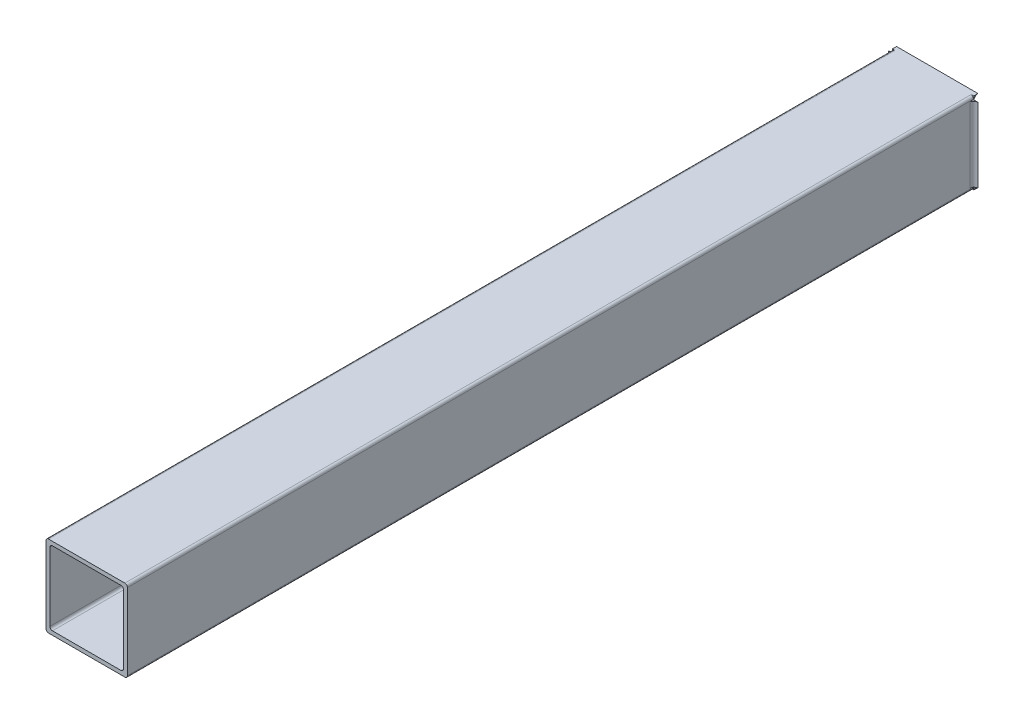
SolidWorks part; units mm, degrees
ref_plane "Front Plane" through (0, 0, 0) normal (0, 0, 1) x (1, 0, 0)
ref_plane "Top Plane" through (0, 0, 0) normal (0, 1, 0) x (1, 0, 0)
ref_plane "Right Plane" through (0, 0, 0) normal (1, 0, 0) x (0, 0, -1)
sketch "Sketch1" plane through (0, 0, 0) normal (0, 0, 1) x (1, 0, 0)
  line L1 (-31.75, -31.75) -> (31.75, -31.75)
  line L2 (-31.75, -31.75) -> (-31.75, 31.75)
  line L3 (-31.75, 31.75) -> (31.75, 31.75)
  line L4 (31.75, -31.75) -> (31.75, 31.75)
  line L5 (-31.75, -31.75) -> (31.75, 31.75) construction
  line L6 (-31.75, 31.75) -> (31.75, -31.75) construction
  line L7 (-28.702, -28.702) -> (28.702, -28.702)
  line L8 (-28.702, -28.702) -> (-28.702, 28.702)
  line L9 (-28.702, 28.702) -> (28.702, 28.702)
  line L10 (28.702, -28.702) -> (28.702, 28.702)
  line L11 (-28.702, -28.702) -> (28.702, 28.702) construction
  line L12 (-28.702, 28.702) -> (28.702, -28.702) construction
  point P0 (0, 0)
  point P6 (0, 0)
  dimension "D1" = 63.5
  dimension "D2" = 3.048
extrude "Boss-Extrude1" add sketch "Sketch1" along normal blind 660
fillet "Fillet1" radius 2 8 edges at (28.702, -28.702, 330) (-28.702, -28.702, 330) (-31.75, -31.75, 330) (31.75, -31.75, 330) (-28.702, 28.702, 330) (31.75, 31.75, 330) (28.702, 28.702, 330) (-31.75, 31.75, 330)
sketch "Sketch2" plane through (0, 0, 0) normal (1, 0, 0) x (0, 0, -1)
  line L0 (0, 28.575) -> (0, 31.75)
  line L1 (0, 31.75) -> (3.175, 31.75)
  line L2 (0, -28.575) -> (0, -31.75)
  line L3 (0, -31.75) -> (3.175, -31.75)
  line L4 (0, -29.75) -> (0, 29.75) construction
  arc A0 (0, -28.575) -> (3.175, -31.75) centre (3.175, -28.575) ccw
  arc A1 (3.175, 31.75) -> (0, 28.575) centre (3.175, 28.575) ccw
  arc A2 (3.175, 31.75) -> (0, 28.575) centre (3.175, 28.575) ccw construction
extrude "Boss-Extrude2" add sketch "Sketch2" along normal mid plane 63.5
fillet "Fillet2" radius 0.5 4 edges at (31.1642, 31.1642, 0) (31.1642, -31.1642, 0) (-31.1642, -31.1642, 0) (-31.1642, 31.1642, 0)
sketch "Sketch3" plane through (0, 0, 0) normal (0, 1, 0) x (1, 0, 0)
  line L5 (-34.925, 0) -> (-31.75, 0)
  line L7 (-31.75, 0) -> (-31.75, -3.175)
  line L8 (34.925, 0) -> (31.75, 0)
  line L9 (31.75, 0) -> (31.75, -3.175)
  line L10 (31.75, -0.5) -> (31.75, 0) construction
  line L11 (31.75, 3.175) -> (31.75, 0) construction
  arc A2 (34.925, 0) -> (31.75, -3.175) centre (34.925, -3.175) ccw
  arc A3 (-31.75, -3.175) -> (-34.925, 0) centre (-34.925, -3.175) ccw
extrude "Boss-Extrude3" add sketch "Sketch3" along normal mid plane 58
fillet "Fillet3" radius 0.5 4 edges at (31.75, -29, 1.5875) (31.75, 29, 1.5875) (-31.75, -29, 1.5875) (-31.75, 29, 1.5875)
